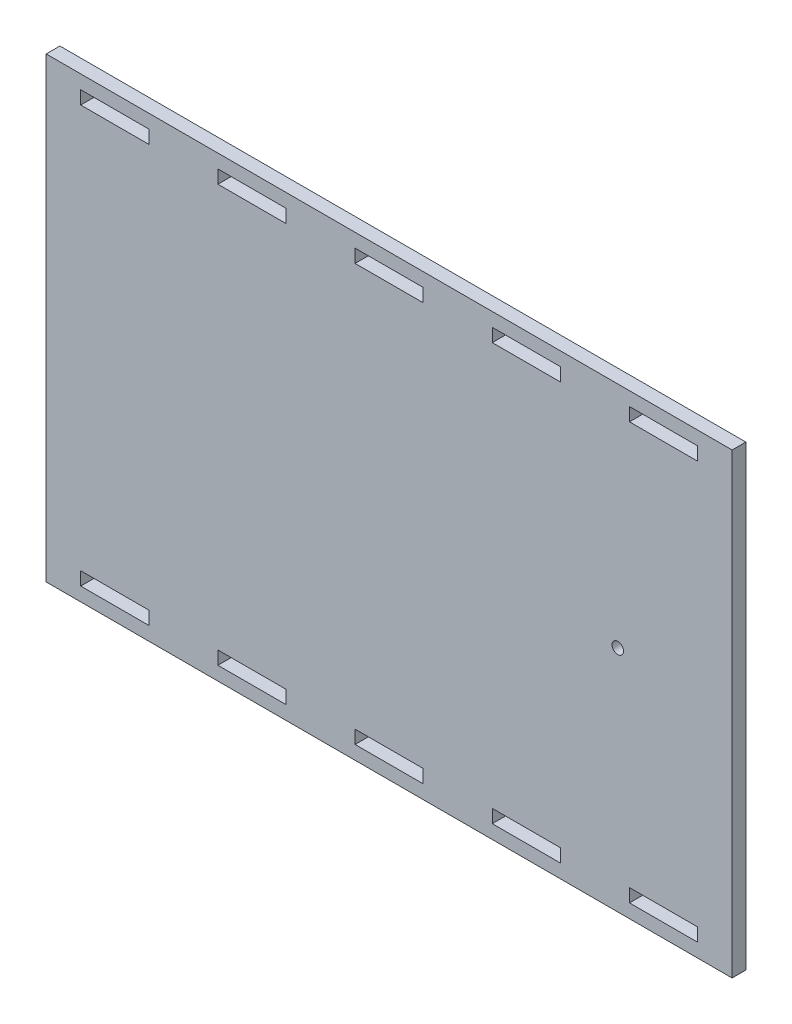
SolidWorks part; units mm, degrees
ref_plane "Alzado" through (0, 0, 0) normal (0, 0, 1) x (1, 0, 0)
ref_plane "Planta" through (0, 0, 0) normal (0, 1, 0) x (1, 0, 0)
ref_plane "Vista lateral" through (0, 0, 0) normal (1, 0, 0) x (0, 0, -1)
sketch "Sketch2" plane through (0, 0, 0) normal (0, 0, 1) x (1, 0, 0)
  line L1 (-150, -100) -> (150, -100)
  line L2 (-150, -100) -> (-150, 100)
  line L3 (-150, 100) -> (150, 100)
  line L4 (150, -100) -> (150, 100)
  line L5 (-150, -100) -> (150, 100) construction
  line L6 (-150, 100) -> (150, -100) construction
  point P0 (0, 0)
  dimension "D1" = 300
  dimension "D2" = 200
extrude "Boss-Extrude1" add sketch "Sketch2" along normal blind 6
sketch "Sketch3" plane through (0, 0, 6) normal (0, 0, 1) x (1, 0, 0)
  line L0 (-150, 0) -> (150, 0) construction
  line L1 (-150, 100) -> (-150, -100) construction
  line L2 (150, -100) -> (150, 100) construction
  line L3 (-150, -100) -> (150, -100) construction
  line L4 (-134.9, -88.2) -> (-105.1, -88.2)
  line L5 (-134.9, -88.2) -> (-134.9, -94)
  line L6 (-134.9, -94) -> (-105.1, -94)
  line L7 (-105.1, -88.2) -> (-105.1, -94)
  line L8 (-74.9, -88.2) -> (-45.1, -88.2)
  line L9 (-74.9, -88.2) -> (-74.9, -94)
  line L10 (-74.9, -94) -> (-45.1, -94)
  line L11 (-45.1, -88.2) -> (-45.1, -94)
  line L12 (-14.9, -88.2) -> (14.9, -88.2)
  line L13 (-14.9, -88.2) -> (-14.9, -94)
  line L14 (-14.9, -94) -> (14.9, -94)
  line L15 (14.9, -88.2) -> (14.9, -94)
  line L16 (45.1, -88.2) -> (74.9, -88.2)
  line L17 (45.1, -88.2) -> (45.1, -94)
  line L18 (45.1, -94) -> (74.9, -94)
  line L19 (74.9, -88.2) -> (74.9, -94)
  line L20 (105.1, -88.2) -> (134.9, -88.2)
  line L21 (105.1, -88.2) -> (105.1, -94)
  line L22 (105.1, -94) -> (134.9, -94)
  line L23 (134.9, -88.2) -> (134.9, -94)
  line L24 (134.9, 88.2) -> (134.9, 94)
  line L25 (105.1, 94) -> (134.9, 94)
  line L26 (105.1, 88.2) -> (105.1, 94)
  line L27 (105.1, 88.2) -> (134.9, 88.2)
  line L28 (74.9, 88.2) -> (74.9, 94)
  line L29 (45.1, 94) -> (74.9, 94)
  line L30 (45.1, 88.2) -> (45.1, 94)
  line L31 (45.1, 88.2) -> (74.9, 88.2)
  line L32 (14.9, 88.2) -> (14.9, 94)
  line L33 (-14.9, 94) -> (14.9, 94)
  line L34 (-14.9, 88.2) -> (-14.9, 94)
  line L35 (-14.9, 88.2) -> (14.9, 88.2)
  line L36 (-45.1, 88.2) -> (-45.1, 94)
  line L37 (-74.9, 94) -> (-45.1, 94)
  line L38 (-74.9, 88.2) -> (-74.9, 94)
  line L39 (-74.9, 88.2) -> (-45.1, 88.2)
  line L40 (-105.1, 88.2) -> (-105.1, 94)
  line L41 (-134.9, 94) -> (-105.1, 94)
  line L42 (-134.9, 88.2) -> (-134.9, 94)
  line L43 (-134.9, 88.2) -> (-105.1, 88.2)
  point P48 (-120, -88.2)
  dimension "D1" = 29.8
  dimension "D2" = 5.8
  dimension "D3" = 6
  dimension "D4" = 30
  dimension "D5" = 5
extrude "Cut-Extrude1" cut sketch "Sketch3" against normal up to next
sketch "Sketch4" plane through (0, 0, 6) normal (0, 0, 1) x (1, 0, 0)
  line L0 (150, -100) -> (150, 100) construction
  circle A0 centre (100, 0) radius 2.5
  dimension "D1" = 5
  dimension "D2" = 50
extrude "Cut-Extrude2" cut sketch "Sketch4" against normal up to next
